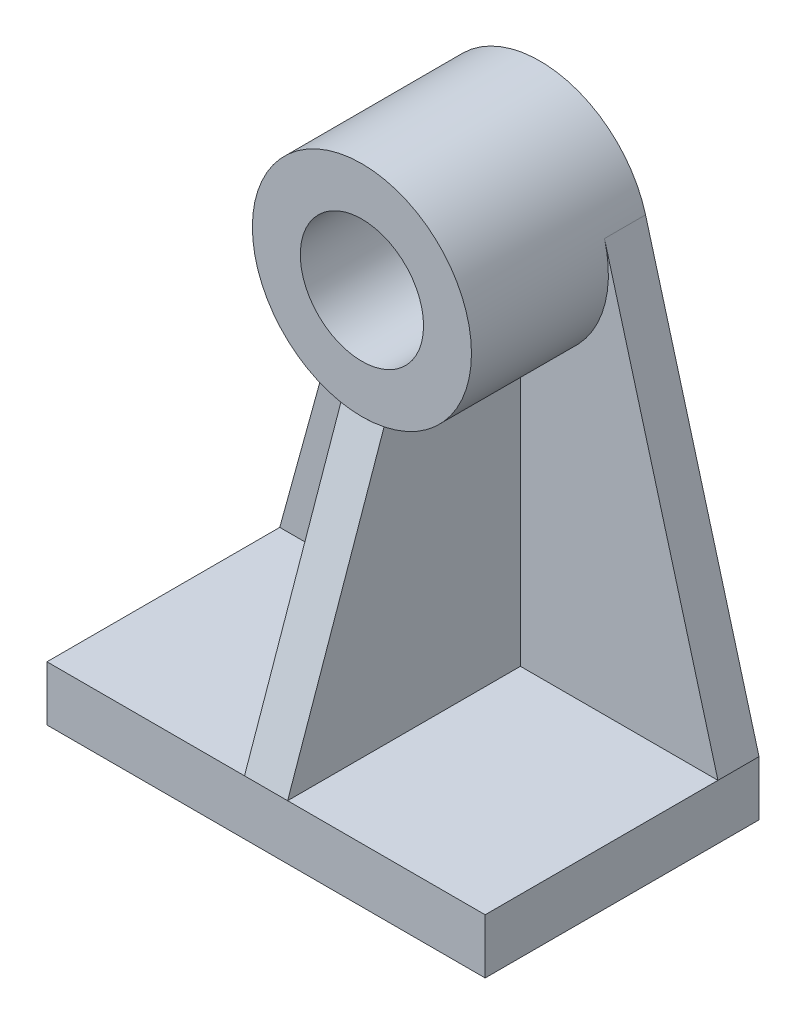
SolidWorks part; units mm, degrees
ref_plane "Plane1" through (0, 0, 0) normal (0, 0, 1) x (1, 0, 0)
ref_plane "Plane2" through (0, 0, 0) normal (0, 1, 0) x (1, 0, 0)
ref_plane "Rib Plane" through (0, 0, 0) normal (1, 0, 0) x (0, 0, -1)
sketch "Sketch1" plane through (0, 0, 0) normal (0, 0, 1) x (1, 0, 0)
  line L0 (-50.8, -101.6) -> (50.8, -101.6)
  line L1 (-50.8, -101.6) -> (-50.8, -88.9)
  line L2 (-50.8, -88.9) -> (-24.4902, 6.7373)
  line L3 (50.8, -101.6) -> (50.8, -88.9)
  line L4 (50.8, -88.9) -> (24.4902, 6.7373)
  arc A0 (24.4902, 6.7373) -> (-24.4902, 6.7373) centre (0, 0) ccw
  point P5 (0, -101.6)
  dimension "D1" = 50.8
  dimension "D2" = 101.6
  dimension "D3" = 101.6
  dimension "D4" = 12.7
extrude "Base-Extrude" add sketch "Sketch1" along normal blind 9.525
sketch "Sketch2" plane through (0, 0, 9.525) normal (0, 0, 1) x (1, 0, 0)
  line L0 (50.8, -101.6) -> (50.8, -88.9) construction
  line L1 (-50.8, -101.6) -> (50.8, -101.6) construction
  line L2 (-50.8, -88.9) -> (-50.8, -101.6) construction
  line L3 (50.8, -101.6) -> (50.8, -88.9)
  line L4 (-50.8, -101.6) -> (50.8, -101.6)
  line L5 (-50.8, -88.9) -> (-50.8, -101.6)
  line L6 (-50.8, -88.9) -> (50.8, -88.9)
extrude "Boss-Extrude1" add sketch "Sketch2" along normal blind 53.975
sketch "Sketch3" plane through (0, 0, 9.525) normal (0, 0, 1) x (1, 0, 0)
  circle A0 centre (0, 0) radius 25.4
  arc A1 (24.4902, 6.7373) -> (-24.4902, 6.7373) centre (0, 0) ccw construction
extrude "Boss-Extrude2" add sketch "Sketch3" along normal blind 31.75
sketch "Sketch4" plane through (0, 0, 41.275) normal (0, 0, 1) x (1, 0, 0)
  circle A0 centre (0, 0) radius 14.2875
  dimension "D1" = 28.575
extrude "Cut-Extrude1" cut sketch "Sketch4" against normal through all
sketch "Sketch5" plane through (0, 0, 0) normal (1, 0, 0) x (0, 0, -1)
  line L0 (-63.5, -88.9) -> (-41.275, -25.4)
  line L1 (-41.275, 25.4) -> (-41.275, -25.4) construction
rib "Rib1" sketch "Sketch5" sketch "Sketch5" thickness 10 extrusion direction parallel to sketch draft on no parameters "D1"=10
